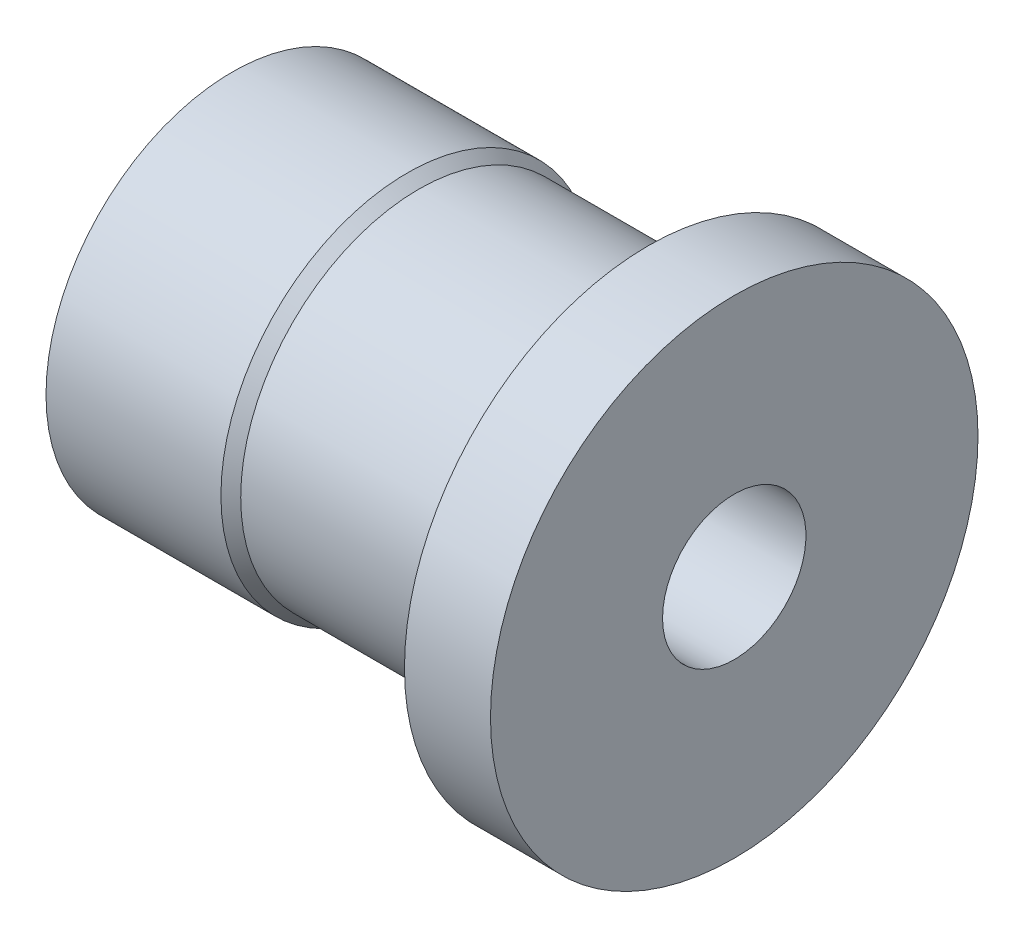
SolidWorks part; units mm, degrees
ref_plane "Piano frontale" through (0, 0, 0) normal (0, 0, 1) x (1, 0, 0)
ref_plane "Piano superiore" through (0, 0, 0) normal (0, 1, 0) x (1, 0, 0)
ref_plane "Piano destro" through (0, 0, 0) normal (1, 0, 0) x (0, 0, -1)
sketch "Schizzo1" plane through (0, 0, 0) normal (0, 1, 0) x (1, 0, 0)
  line L0 (-8.75, 0) -> (8.75, 0) construction
  line L1 (-8.75, 2.5) -> (8.75, 2.5)
  line L2 (8.75, 2.5) -> (8.75, 8.5)
  line L3 (8.75, 8.5) -> (5.75, 8.5)
  line L4 (5.75, 8.5) -> (5.75, 6.21)
  line L5 (5.75, 6.21) -> (-2.25, 6.21)
  line L6 (-2.25, 6.21) -> (-2.6505, 6.5)
  line L7 (-2.6505, 6.5) -> (-8.75, 6.5)
  line L8 (-8.75, 6.5) -> (-8.75, 2.5)
  point P2 (0, 0)
  dimension "D1" = 17.5
  dimension "D2" = 2.5
  dimension "D3" = 6.5
  dimension "D4" = 6.21
  dimension "D5" = 8.5
  dimension "D6" = 8
  dimension "D7" = 11
revolve "Rivoluzione1" add sketch "Schizzo1" angle 360 about L0
sketch "Schizzo2" plane through (0, 0, 0) normal (0, 1, 0) x (1, 0, 0)
  line L0 (0, 0) -> (-8.75, 0) construction
  line L1 (-8.75, 6.5) -> (-8.75, -6.5) construction
  circle A0 centre (-5.75, 0) radius 1.5
  dimension "D1" = 3
  dimension "D2" = 3
extrude "Taglio-Estrusione1" cut sketch "Schizzo2" against normal blind 10
